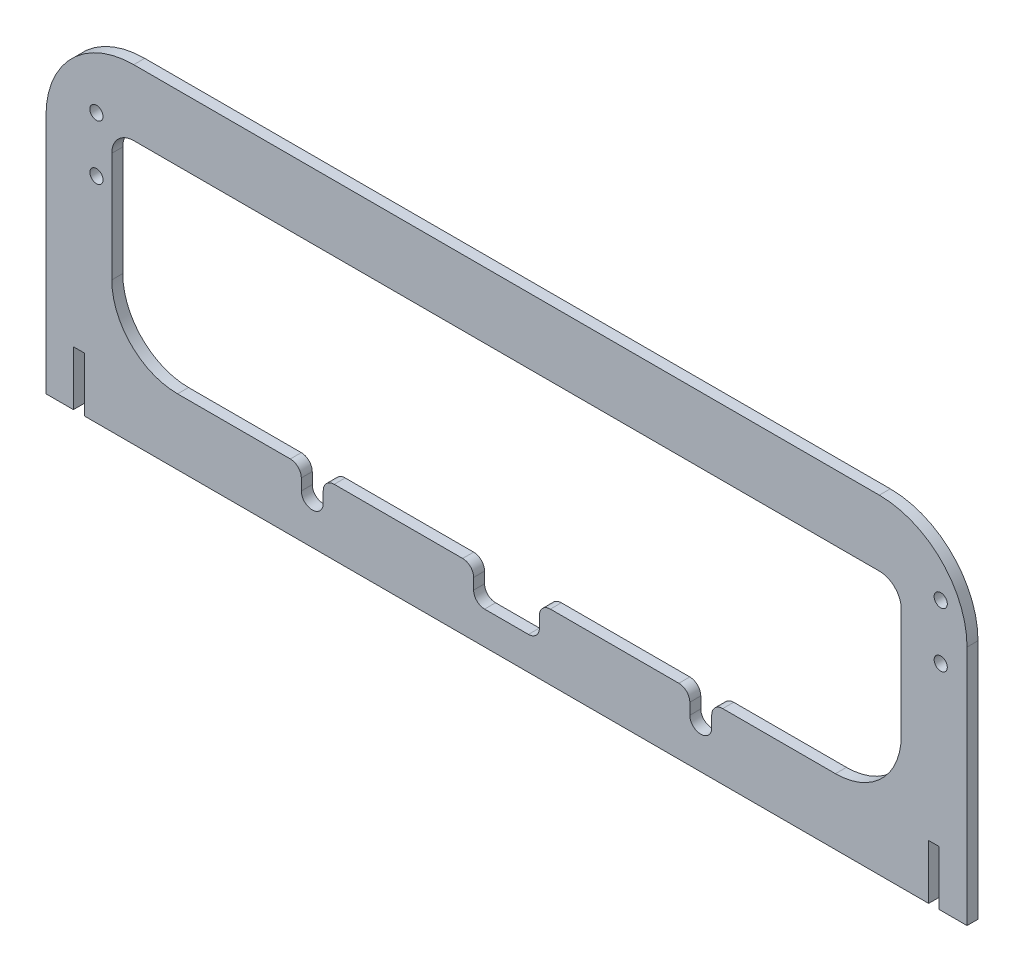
SolidWorks part; units mm, degrees
ref_plane "Alzado" through (0, 0, 0) normal (0, 0, 1) x (1, 0, 0)
ref_plane "Planta" through (0, 0, 0) normal (0, 1, 0) x (1, 0, 0)
ref_plane "Vista lateral" through (0, 0, 0) normal (1, 0, 0) x (0, 0, -1)
sketch "Croquis1" plane through (0, 0, 0) normal (0, 0, 1) x (1, 0, 0)
  line L0 (210, 0) -> (-210, 0)
  line L1 (-210, 0) -> (-210, 15) construction
  line L2 (-170, 55) -> (170, 55) construction
  line L3 (0, 0) -> (0, 55) construction
  line L4 (210, 0) -> (210, 15) construction
  line L5 (-210, 0) -> (-210, 110)
  line L6 (-170, 150) -> (170, 150)
  line L7 (210, 110) -> (210, 0)
  line L8 (-180, 60) -> (-180, 110)
  line L9 (-170, 120) -> (170, 120)
  line L10 (180, 110) -> (180, 60)
  line L11 (-150, 30) -> (150, 30)
  line L12 (-180, 0) -> (-180, 110) construction
  line L13 (180, 110) -> (180, 0) construction
  arc A0 (-210, 15) -> (-170, 55) centre (-170, 15) cw construction
  arc A1 (210, 15) -> (170, 55) centre (170, 15) ccw construction
  arc A2 (-210, 110) -> (-170, 150) centre (-170, 110) cw
  arc A3 (170, 150) -> (210, 110) centre (170, 110) cw
  arc A4 (-180, 110) -> (-170, 120) centre (-170, 110) cw
  arc A5 (170, 120) -> (180, 110) centre (170, 110) cw
  arc A6 (-150, 30) -> (-180, 60) centre (-150, 60) cw
  arc A7 (150, 30) -> (180, 60) centre (150, 60) ccw
  dimension "D3" = 40
  dimension "D4" = 40
  dimension "D8" = 30
  dimension "D1" = 55
  dimension "D2" = 210
  dimension "D5" = 150
  dimension "D7" = 30
  dimension "D6" = 30
extrude "Saliente-Extruir1" add sketch "Croquis1" along normal mid plane 5
extrude "Cortar-Extruir1" cut sketch "Croquis2" against normal blind 10
sketch "Croquis2" plane through (0, 0, -2.5) normal (0, 0, -1) x (-1, 0, 0)
  line L0 (-93.5802, 19.8636) -> (-93.5802, 39.8636)
  line L1 (-93.5802, 39.8636) -> (-83.5802, 39.8636)
  line L2 (-83.5802, 39.8636) -> (-83.5802, 19.8636)
  arc A0 (-93.5802, 19.8636) -> (-83.5802, 19.8636) centre (-88.5802, 19.8636) ccw
sketch "Croquis3" plane through (0, 0, 2.5) normal (0, 0, 1) x (1, 0, 0)
  line L0 (0, 0) -> (0, 30) construction
  line L1 (15, 45) -> (-15, 45)
  line L2 (15, 45) -> (15, 15)
  line L3 (15, 15) -> (-15, 15)
  line L4 (-15, 45) -> (-15, 15)
  line L5 (15, 45) -> (-15, 15) construction
  line L6 (15, 15) -> (-15, 45) construction
  line L7 (-150, 30) -> (83.5802, 30) construction
  line L8 (-210, 0) -> (210, 0) construction
  point P0 (0, 30)
  dimension "D1" = 30
  dimension "D2" = 15
extrude "Cortar-Extruir2" cut sketch "Croquis3" against normal blind 10
mirror "Simetría1" about plane through (0, 0, 0) normal (1, 0, 0) of "Cortar-Extruir1"
fillet "Redondeo1" radius 5 8 edges at (93.5802, 30, 0) (83.5802, 30, 0) (-15, 15, 0) (15, 15, 0) (-15, 30, 0) (15, 30, 0) (-83.5802, 30, 0) (-93.5802, 30, 0)
sketch "Croquis4" plane through (0, 0, 2.5) normal (0, 0, 1) x (1, 0, 0)
  line L0 (-210, 0) -> (210, 0) construction
  line L1 (-197.5, 0) -> (-192.5, 0)
  line L2 (-197.5, 0) -> (-197.5, 24.8636)
  line L3 (-197.5, 24.8636) -> (-192.5, 24.8636)
  line L4 (-192.5, 0) -> (-192.5, 24.8636)
  line L5 (-197.5, 0) -> (-197.5, 15) construction
  line L7 (197.2862, 0) -> (192.5, 0)
  line L8 (197.2862, 0) -> (197.2862, 24.8636)
  line L9 (197.2862, 24.8636) -> (192.5, 24.8636)
  line L10 (192.5, 0) -> (192.5, 24.8636)
  point P14 (197.2862, 24.8636)
extrude "Cortar-Extruir3" cut sketch "Croquis4" against normal blind 5
sketch "Croquis5" plane through (0, 0, -2.5) normal (0, 0, -1) x (-1, 0, 0)
  circle A0 centre (187, 97.5) radius 3
  circle A1 centre (187, 122.5) radius 3
  circle A2 centre (-198, 122.5) radius 3
  circle A3 centre (-198, 97.5) radius 3
extrude "Cortar-Extruir4" cut sketch "Croquis5" against normal through all
